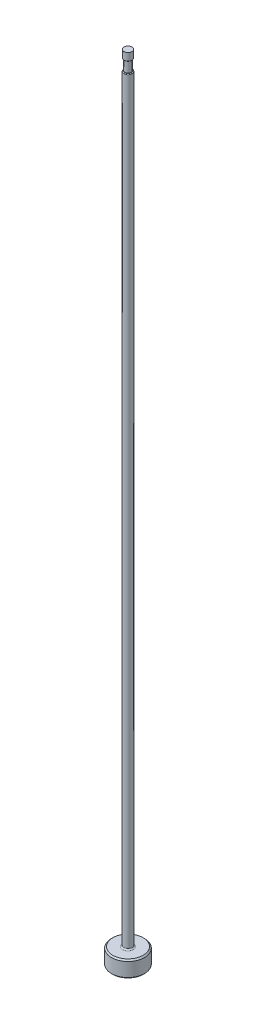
SolidWorks part; units mm, degrees
ref_plane "Front Plane" through (0, 0, 0) normal (0, 0, 1) x (1, 0, 0)
ref_plane "Top Plane" through (0, 0, 0) normal (0, 1, 0) x (1, 0, 0)
ref_plane "Right Plane" through (0, 0, 0) normal (1, 0, 0) x (0, 0, -1)
other "Configuration Table"
sketch "Sketch1" plane through (0, 0, 0) normal (0, 0, 1) x (1, 0, 0)
  line L0 (0, 259.9588) -> (0, -15.1925) construction
  line L1 (0, 0) -> (-3.175, 0)
  line L2 (-3.175, 0) -> (-3.175, 3.175)
  line L3 (-3.175, 3.175) -> (-0.7937, 3.175)
  line L4 (-0.7937, 3.175) -> (-0.7937, 152.4)
  line L5 (-0.7937, 152.4) -> (0, 152.4)
  line L6 (0, 152.4) -> (0, 0)
  dimension "L" = 152.4
  dimension "H" = 6.35
  dimension "T" = 3.175
  dimension "D" = 1.5875
revolve "Revolve1" add sketch "Sketch1" angle 360 about L0
chamfer "Chamfer1" distance 0.254 angle 45 2 edges at (0, 3.175, 3.175) (0, 0, 3.175)
fillet "Fillet1" radius 0.254 1 edges at (0, 3.175, 0.7937)
sketch "Sketch2" plane through (0, 0, 0) normal (0, 0, 1) x (1, 0, 0)
  line L0 (-0.7937, 152.4) -> (-0.7937, 3.429) construction
  line L1 (-0.7937, 150.876) -> (-0.5905, 150.876)
  line L2 (-0.7937, 150.876) -> (-0.7937, 148.844)
  line L3 (-0.7937, 148.844) -> (-0.5905, 148.844)
  line L4 (-0.5905, 150.876) -> (-0.5905, 148.844)
  line L5 (0.7937, 152.4) -> (-0.7937, 152.4) construction
  line L6 (0, 153.4483) -> (0, 147.3282) construction
  dimension "D1" = 2.032
  dimension "N" = 1.524
  dimension "FD" = 0.2032
  dimension "D3" = 1.1811
revolve "Vent Relief" cut sketch "Sketch2" angle 360 about L6
sketch "Sketch3" plane through (0, 0, 0) normal (0, 0, 1) x (1, 0, 0)
  line L0 (-0.5905, 149.86) -> (-0.5905, 86.36)
  line L1 (-0.5905, 150.876) -> (-0.5905, 148.844) construction
  line L2 (-0.7937, 148.844) -> (-0.7937, 3.429) construction
  line L3 (-0.7937, 85.2424) -> (-0.7937, 149.86)
  line L4 (-0.7937, 149.86) -> (-0.5905, 149.86)
  arc A0 (-0.5905, 86.36) -> (-0.7937, 85.2424) centre (-3.7655, 86.36) cw
  dimension "D1" = 3.175
  dimension "D2" = 63.5
extrude "D-Slot" cut sketch "Sketch3" against normal through all both and the other way through all
sketch "Sketch5" plane through (0, 0, 0) normal (0, 0, 1) x (1, 0, 0)
  line L0 (-0.7937, 150.876) -> (0.7937, 150.876) construction
  line L1 (-0.7937, 152.4) -> (-0.7683, 152.4)
  line L2 (-0.7937, 152.4) -> (-0.7937, 150.876)
  line L3 (-0.7937, 150.876) -> (-0.7683, 150.876)
  line L4 (-0.7683, 152.4) -> (-0.7683, 150.876)
  line L5 (0, 152.6877) -> (0, 150.5771) construction
  dimension "VP" = 0.0254
revolve "Vent Diameter" cut sketch "Sketch5" angle 360 about L5
fillet "Fillet2" radius 0.127 2 edges at (0.7937, 148.844, 0) (0, 150.876, 0.7683)
sketch "Pocket Sketch" plane through (0, 0, 0) normal (0, 0, 1) x (1, 0, 0)
  line L0 (-3.5719, 0) -> (-3.5719, 3.2004)
  line L1 (-3.5719, 3.2004) -> (-1.7542, 3.2004)
  line L2 (-0.9922, 3.9624) -> (-0.9922, 22.225)
  line L3 (-0.9922, 22.225) -> (0, 22.225)
  line L4 (0, 22.225) -> (0, 0)
  line L5 (0, 0) -> (-3.5719, 0)
  line L6 (0, 12.6104) -> (0, -2.4989) construction
  line L7 (-3.175, 2.921) -> (-3.175, 0.254) construction
  line L8 (2.921, 3.175) -> (-2.921, 3.175) construction
  line L9 (-0.7937, 85.2424) -> (-0.7937, 3.429) construction
  line L10 (-1.7542, 3.2004) -> (-0.9922, 3.9624)
  point P3 (-0.9922, 3.2004)
  dimension "D1" = 7.1437
  dimension "D2" = 0.3969
  dimension "D3" = 0.0254
  dimension "D4" = 0.1984
  dimension "D5" = 1.9844
  dimension "D6" = 22.225
